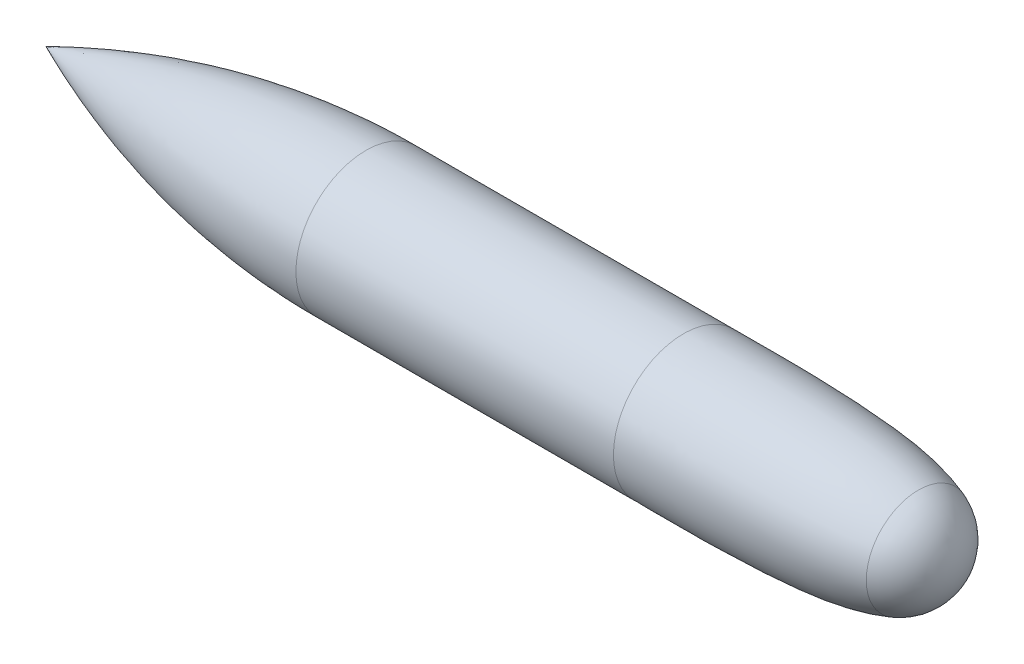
SolidWorks part; units mm, degrees
ref_plane "Front Plane" through (0, 0, 0) normal (0, 0, 1) x (1, 0, 0)
ref_plane "Top Plane" through (0, 0, 0) normal (0, 1, 0) x (1, 0, 0)
ref_plane "Right Plane" through (0, 0, 0) normal (1, 0, 0) x (0, 0, -1)
sketch "Sketch1" plane through (0, 0, 0) normal (0, 0, 1) x (1, 0, 0)
  line L0 (-1512.6489, 0) -> (4937.7933, 0) construction
  line L1 (1850.39, 405.13) -> (3686.81, 405.13)
  line L2 (5257.8, 855.6424) -> (5257.8, -1069.2104) construction
  line L3 (5045.3781, 0) -> (5478.1924, 0) construction
  line L4 (0, 0) -> (5257.8, 0)
  arc A0 (5257.8, 0) -> (5045.3781, 301.3798) centre (4937.7933, 0) ccw
  spline S0 degree 3 poles (0, 0) (585.2734, 258.5051) (1209.4705, 405.13) (1850.39, 405.13) knots 0 0 0 0 1 1 1 1
  spline S1 degree 3 poles (3686.81, 405.13) (3979.8018, 405.13) (4444.956, 411.2563) (4898.1058, 353.9523) (5045.3781, 301.3798) knots 0 0 0 0 0.660229 1 1 1 1
  dimension "D1" = 1850.39
  dimension "D2" = 3686.81
  dimension "D3" = 810.26
  dimension "D4" = 5257.8
revolve "Revolve1" add sketch "Sketch1" angle 360 about L0
